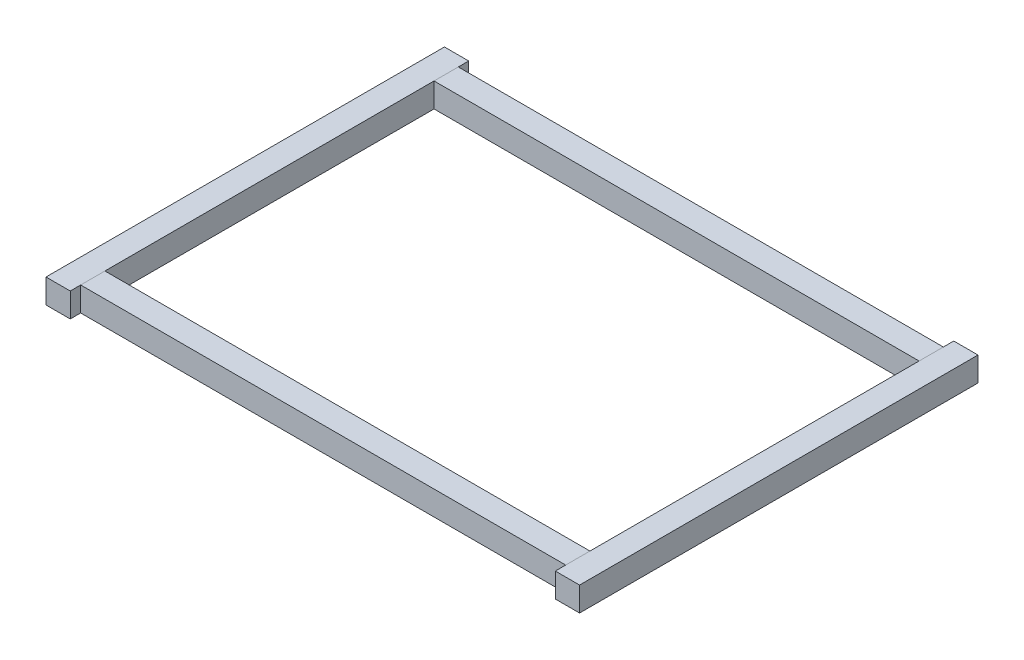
SolidWorks part; units mm, degrees
ref_plane "Plan de face" through (0, 0, 0) normal (0, 0, 1) x (1, 0, 0)
ref_plane "Plan de dessus" through (0, 0, 0) normal (0, 1, 0) x (1, 0, 0)
ref_plane "Plan de droite" through (0, 0, 0) normal (1, 0, 0) x (0, 0, -1)
sketch "Esquisse1" plane through (0, 0, 0) normal (0, 0, 1) x (1, 0, 0)
  line L0 (294, 14) -> (280, 14)
  line L1 (0, 0) -> (-14, 0)
  line L2 (0, 0) -> (0, 14)
  line L3 (0, 14) -> (-14, 14)
  line L4 (-14, 0) -> (-14, 14)
  line L5 (294, 0) -> (294, 14)
  line L6 (280, 0) -> (280, 14)
  line L7 (294, 0) -> (280, 0)
  dimension "D1" = 14
  dimension "D2" = 14
extrude "Boss.-Extru.1" add sketch "Esquisse1" along normal blind 230
sketch "Esquisse2" plane through (0, 0, 0) normal (1, 0, 0) x (0, 0, -1)
  line L0 (-230, 14) -> (0, 14) construction
  line L1 (-20, 14) -> (-6, 14)
  line L2 (-20, 14) -> (-20, 0)
  line L3 (-20, 0) -> (-6, 0)
  line L4 (-6, 14) -> (-6, 0)
  line L5 (-230, 0) -> (0, 0) construction
  line L6 (0, 0) -> (0, 14) construction
  line L7 (-224, 14) -> (-210, 14)
  line L8 (-224, 14) -> (-224, 0)
  line L9 (-224, 0) -> (-210, 0)
  line L10 (-210, 14) -> (-210, 0)
  dimension "D1" = 14
  dimension "D2" = 14
  dimension "D3" = 6
  dimension "D4" = 190
extrude "Boss.-Extru.2" add sketch "Esquisse2" along normal up to next separate body
